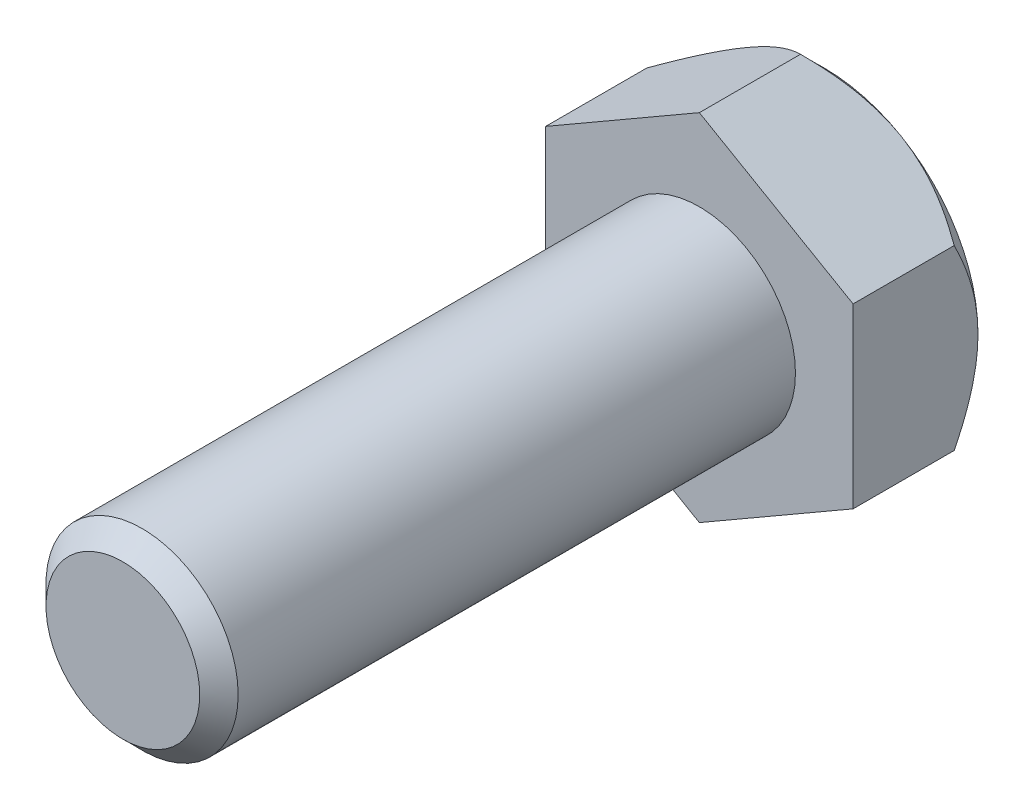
SolidWorks part; units mm, degrees
ref_plane "Płaszczyzna przednia" through (0, 0, 0) normal (0, 0, 1) x (1, 0, 0)
ref_plane "Płaszczyzna górna" through (0, 0, 0) normal (0, 1, 0) x (1, 0, 0)
ref_plane "Płaszczyzna prawa" through (0, 0, 0) normal (1, 0, 0) x (0, 0, -1)
sketch "Szkic1" plane through (0, 0, 0) normal (0, 0, 1) x (1, 0, 0)
  line L1 (0, 18.4752) -> (-16, 9.2376)
  line L2 (-16, 9.2376) -> (-16, -9.2376)
  line L3 (-16, -9.2376) -> (0, -18.4752)
  line L4 (0, -18.4752) -> (16, -9.2376)
  line L5 (16, -9.2376) -> (16, 9.2376)
  line L6 (16, 9.2376) -> (0, 18.4752)
  circle A0 centre (0, 0) radius 16 construction
  dimension "D1" = 32
extrude "Dodanie-wyciągnięcie1" add sketch "Szkic1" along normal blind 13
sketch "Szkic2" plane through (0, 0, 13) normal (0, 0, 1) x (1, 0, 0)
  circle A0 centre (0, 0) radius 10
  dimension "D1" = 20
extrude "Dodanie-wyciągnięcie2" add sketch "Szkic2" along normal blind 60
chamfer "Sfazowanie1" distance 2 angle 45 1 edges at (10, 0, 73)
sketch "Szkic3" plane through (0, 0, 0) normal (0, 0, -1) x (-1, 0, 0)
  line L0 (-16, 9.2376) -> (0, 18.4752) construction
  circle A0 centre (0, 0) radius 16
extrude "Wytnij-wyciągnięcie1" cut sketch "Szkic3" against normal through all draft 45 flip side to cut
